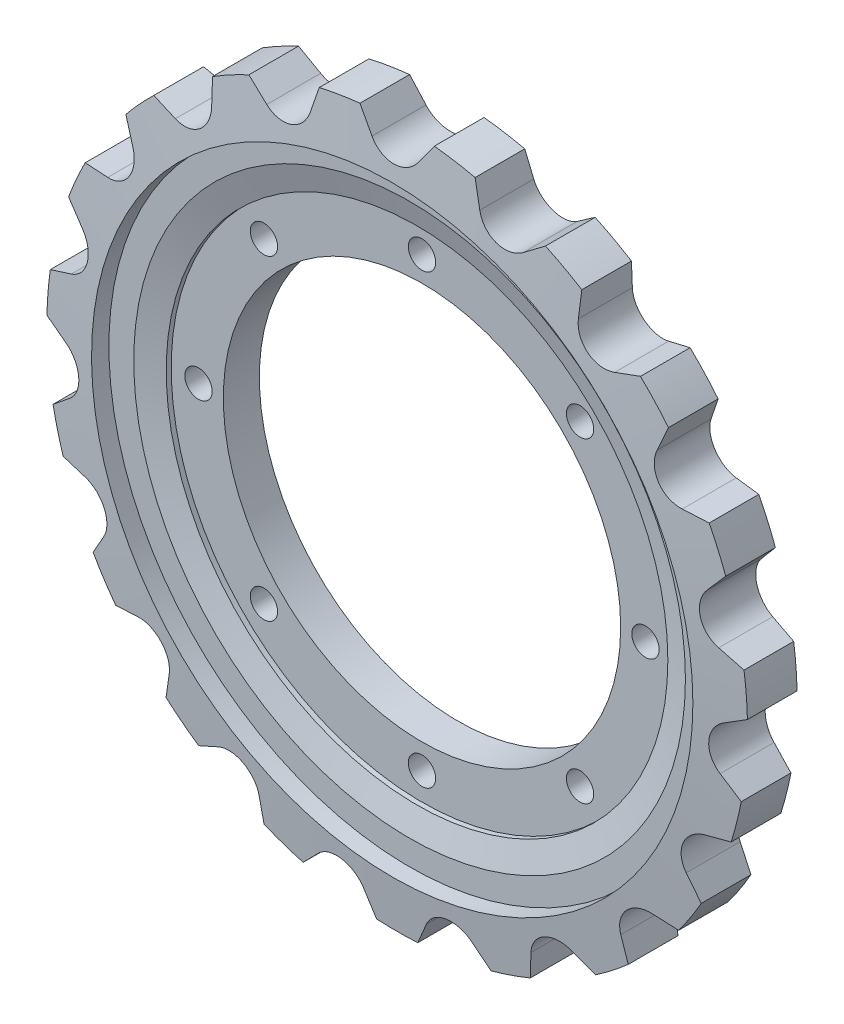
SolidWorks part; units mm, degrees
ref_plane "Face" through (0, 0, 0) normal (0, 0, 1) x (1, 0, 0)
ref_plane "Dessus" through (0, 0, 0) normal (0, 1, 0) x (1, 0, 0)
ref_plane "Droite" through (0, 0, 0) normal (1, 0, 0) x (0, 0, -1)
sketch "Esquisse1" plane through (0, 0, 0) normal (1, 0, 0) x (0, 0, -1)
  line L0 (-36.7813, 0) -> (67.9327, 0) construction
  line L1 (0, 80) -> (0, 111)
  line L2 (-24.5, 141.075) -> (-4.5, 141.075)
  line L3 (-26.5, 121.075) -> (-24.5, 141.075)
  line L4 (-2.5, 121.075) -> (-9.5, 121.075)
  line L5 (-9.5, 121.075) -> (-9.5, 112.5322)
  line L6 (-9.5, 112.5322) -> (-9.0438, 111)
  line L7 (-9.0438, 111) -> (0, 111)
  line L8 (-2.5, 121.075) -> (-4.5, 141.075)
  line L9 (-26.5, 121.075) -> (-19.5, 121.075)
  line L10 (-19.5, 121.075) -> (-19.5, 111.075)
  line L11 (-19.5, 111.075) -> (-16.5, 101)
  line L12 (-16.5, 101) -> (-14.5, 101)
  line L13 (-14.5, 101) -> (-14.5, 80)
  line L14 (-14.5, 147.4323) -> (-14.5, 112.424) construction
  line L15 (-14.5, 80) -> (0, 80)
  point P5 (0, 0)
  point P6 (0, 0)
  point P19 (0, 0)
  dimension "D1" = 282.15
  dimension "D2" = 14.5
  dimension "D3" = 16.5
  dimension "D4" = 202
  dimension "D5" = 160
  dimension "D6" = 26.5
  dimension "D7" = 20
  dimension "D8" = 10
  dimension "D9" = 10
  dimension "D10" = 10
  dimension "D11" = 10
  dimension "D12" = 20
  dimension "D13" = 24
revolve "Révolution1" add sketch "Esquisse1" angle 360 about L0
hole_wizard "Dégagement M101" positions "Esquisse4" profile "Esquisse3" hole size "M10" standard "ISO"
sketch "Esquisse4" plane through (0, 0, 0) normal (0, 0, -1) x (-1, 0, 0)
  circle A0 centre (0, 0) radius 90 construction
  point P0 (0, 90)
  dimension "D1" = 180
sketch "Esquisse3" plane through (0, 90, 0) normal (1, 0, 0) x (0, 1, 0)
  line L0 (0, 0) -> (0, 26.5)
  line L1 (0, 26.5) -> (5.5, 26.5)
  line L2 (5.5, 26.5) -> (5.5, 0)
  line L5 (5.5, 0) -> (0, 0)
  line L11 (0, -6.35) -> (0, 107.95) construction
  dimension "Diamètre du perçage jusqu'au prochain" = 11
  dimension "Profondeur du perçage jusqu'au prochain" = 26.5
pattern_circular "Répétition circulaire1" count 8 over 360 about axis through (0, 0, 0) along (0, 0, 1) of "Dégagement M101"
sketch "Esquisse5" plane through (0, 0, 0) normal (0, 0, 1) x (1, 0, 0)
  line L0 (-9.2564, 132.1086) -> (-14.9766, 140.2778)
  line L1 (9.2564, 132.1086) -> (14.9766, 140.2778)
  line L2 (34.1407, 127.9561) -> (31.383, 137.54)
  line L3 (0, 0) -> (0, 138.59) construction
  line L4 (51.6505, 121.945) -> (59.7132, 127.8143)
  line L5 (73.8382, 109.9376) -> (74.3418, 119.8977)
  line L6 (88.4474, 98.5668) -> (97.979, 101.5001)
  line L7 (105.5341, 80.0057) -> (109.2445, 89.2625)
  line L8 (115.6597, 64.5074) -> (125.6273, 64.1868)
  line L9 (125.7938, 41.4039) -> (132.3088, 48.9544)
  line L10 (130.3384, 23.4576) -> (139.6619, 19.9179)
  line L11 (132.4218, -1.6846) -> (141.0354, 3.3414)
  line L12 (130.893, -20.1342) -> (138.5619, -26.5095)
  line L13 (124.6998, -44.5906) -> (134.4787, -42.6338)
  line L14 (117.2633, -61.5442) -> (122.4466, -70.0641)
  line L15 (103.4646, -82.6645) -> (113.3491, -83.989)
  line L16 (90.9262, -96.2849) -> (93.0624, -106.0262)
  line L17 (71.0175, -111.7805) -> (79.9363, -116.2426)
  line L18 (54.736, -120.5916) -> (53.5934, -130.4987)
  line L19 (30.8745, -128.7832) -> (37.8613, -135.8995)
  line L20 (12.6142, -131.8304) -> (8.3167, -140.8296)
  line L21 (-12.6142, -131.8304) -> (-8.3167, -140.8296)
  line L22 (-30.8745, -128.7832) -> (-37.8613, -135.8995)
  line L23 (-54.736, -120.5916) -> (-53.5934, -130.4987)
  line L24 (-71.0175, -111.7805) -> (-79.9363, -116.2426)
  line L25 (-90.9262, -96.2849) -> (-93.0624, -106.0262)
  line L26 (-103.4646, -82.6645) -> (-113.3491, -83.989)
  line L27 (-117.2633, -61.5442) -> (-122.4466, -70.0641)
  line L28 (-124.6998, -44.5906) -> (-134.4787, -42.6338)
  line L29 (-130.893, -20.1342) -> (-138.5619, -26.5095)
  line L30 (-132.4218, -1.6846) -> (-141.0354, 3.3414)
  line L31 (-130.3384, 23.4576) -> (-139.6619, 19.9179)
  line L32 (-125.7938, 41.4039) -> (-132.3088, 48.9544)
  line L33 (-115.6597, 64.5074) -> (-125.6273, 64.1868)
  line L34 (-105.5341, 80.0057) -> (-109.2445, 89.2625)
  line L35 (-88.4474, 98.5668) -> (-97.979, 101.5001)
  line L36 (-73.8382, 109.9376) -> (-74.3418, 119.8977)
  line L37 (-51.6505, 121.945) -> (-59.7132, 127.8143)
  line L38 (-34.1407, 127.9561) -> (-31.383, 137.54)
  line L39 (45.0001, 131.0808) -> (0, 0) construction
  line L40 (-5, 127.29) -> (5, 127.29) construction
  circle A0 centre (0, 0) radius 127.315 construction
  circle A1 centre (0, 0) radius 138.59 construction
  circle A2 centre (0, 0) radius 141.075 construction
  arc A3 (-9.2564, 132.1086) -> (9.2564, 132.1086) centre (0, 138.59) ccw
  circle A4 centre (0, 0) radius 141.075
  arc A5 (14.9766, 140.2778) -> (-14.9766, 140.2778) centre (0, 0) ccw
  arc A6 (34.1407, 127.9561) -> (51.6505, 121.945) centre (45.0001, 131.0808) ccw
  arc A7 (59.7132, 127.8143) -> (31.383, 137.54) centre (0, 0) ccw
  arc A8 (73.8382, 109.9376) -> (88.4474, 98.5668) centre (85.1237, 109.367) ccw
  arc A9 (97.979, 101.5001) -> (74.3418, 119.8977) centre (0, 0) ccw
  arc A10 (105.5341, 80.0057) -> (115.6597, 64.5074) centre (116.0229, 75.8015) ccw
  arc A11 (125.6273, 64.1868) -> (109.2445, 89.2625) centre (0, 0) ccw
  arc A12 (125.7938, 41.4039) -> (130.3384, 23.4576) centre (134.3492, 34.0218) ccw
  arc A13 (139.6619, 19.9179) -> (132.3088, 48.9544) centre (0, 0) ccw
  arc A14 (132.4218, -1.6846) -> (130.893, -20.1342) centre (138.1166, -11.4447) ccw
  arc A15 (138.5619, -26.5095) -> (141.0354, 3.3414) centre (0, 0) ccw
  arc A16 (124.6998, -44.5906) -> (117.2633, -61.5442) centre (126.917, -55.671) ccw
  arc A17 (122.4466, -70.0641) -> (134.4787, -42.6338) centre (0, 0) ccw
  arc A18 (103.4646, -82.6645) -> (90.9262, -96.2849) centre (101.964, -93.8645) ccw
  arc A19 (93.0624, -106.0262) -> (113.3491, -83.989) centre (0, 0) ccw
  arc A20 (71.0175, -111.7805) -> (54.736, -120.5916) centre (65.9615, -121.8863) ccw
  arc A21 (53.5934, -130.4987) -> (79.9363, -116.2426) centre (0, 0) ccw
  arc A22 (30.8745, -128.7832) -> (12.6142, -131.8304) centre (22.8112, -136.6998) ccw
  arc A23 (8.3167, -140.8296) -> (37.8613, -135.8995) centre (0, 0) ccw
  arc A24 (-12.6142, -131.8304) -> (-30.8745, -128.7832) centre (-22.8112, -136.6998) ccw
  arc A25 (-37.8613, -135.8995) -> (-8.3167, -140.8296) centre (0, 0) ccw
  arc A26 (-54.736, -120.5916) -> (-71.0175, -111.7805) centre (-65.9615, -121.8863) ccw
  arc A27 (-79.9363, -116.2426) -> (-53.5934, -130.4987) centre (0, 0) ccw
  arc A28 (-90.9262, -96.2849) -> (-103.4646, -82.6645) centre (-101.964, -93.8645) ccw
  arc A29 (-113.3491, -83.989) -> (-93.0624, -106.0262) centre (0, 0) ccw
  arc A30 (-117.2633, -61.5442) -> (-124.6998, -44.5906) centre (-126.917, -55.671) ccw
  arc A31 (-134.4787, -42.6338) -> (-122.4466, -70.0641) centre (0, 0) ccw
  arc A32 (-130.893, -20.1342) -> (-132.4218, -1.6846) centre (-138.1166, -11.4447) ccw
  arc A33 (-141.0354, 3.3414) -> (-138.5619, -26.5095) centre (0, 0) ccw
  arc A34 (-130.3384, 23.4576) -> (-125.7938, 41.4039) centre (-134.3492, 34.0218) ccw
  arc A35 (-132.3088, 48.9544) -> (-139.6619, 19.9179) centre (0, 0) ccw
  arc A36 (-115.6597, 64.5074) -> (-105.5341, 80.0057) centre (-116.0229, 75.8015) ccw
  arc A37 (-109.2445, 89.2625) -> (-125.6273, 64.1868) centre (0, 0) ccw
  arc A38 (-88.4474, 98.5668) -> (-73.8382, 109.9376) centre (-85.1237, 109.367) ccw
  arc A39 (-74.3418, 119.8977) -> (-97.979, 101.5001) centre (0, 0) ccw
  arc A40 (-51.6505, 121.945) -> (-34.1407, 127.9561) centre (-45.0001, 131.0808) ccw
  arc A41 (-31.383, 137.54) -> (-59.7132, 127.8143) centre (0, 0) ccw
  dimension "D1" = 11.3
  dimension "D2" = 277.18
  dimension "D7" = 254.63
  dimension "D3" = 70
  dimension "D5" = 10
  dimension "D4" = 0
extrude "Enlèv. mat.-Extru.1" cut sketch "Esquisse5" along normal through all
sketch "Esquisse6" [suppressed] plane through (0, 0, 0) normal (0, 0, -1) x (-1, 0, 0)
  circle A0 centre (0, 0) radius 101
  dimension "D1" = 202
extrude "Enlèv. mat.-Extru.2" [suppressed] cut sketch "Esquisse6" against normal blind 2.5
ref_plane "Plan1" through (0, 0, 14.5) normal (0, 0, 1) x (1, 0, 0)
ref_plane "Plan2" through (0, 0, 14.5) normal (0, 0, -1) x (-1, 0, 0)
sketch "Esquisse9" plane through (0, 0, 19.5) normal (0, 0, 1) x (1, 0, 0)
  line L1 (-191.7744, 0) -> (176.7086, 0)
  line L2 (-191.7744, 0) -> (-191.7744, -171.3729)
  line L3 (-191.7744, -171.3729) -> (176.7086, -171.3729)
  line L4 (176.7086, 0) -> (176.7086, -171.3729)
extrude "Enlèv. mat.-Extru.3" [suppressed] cut sketch "Esquisse9" against normal mid plane 200
